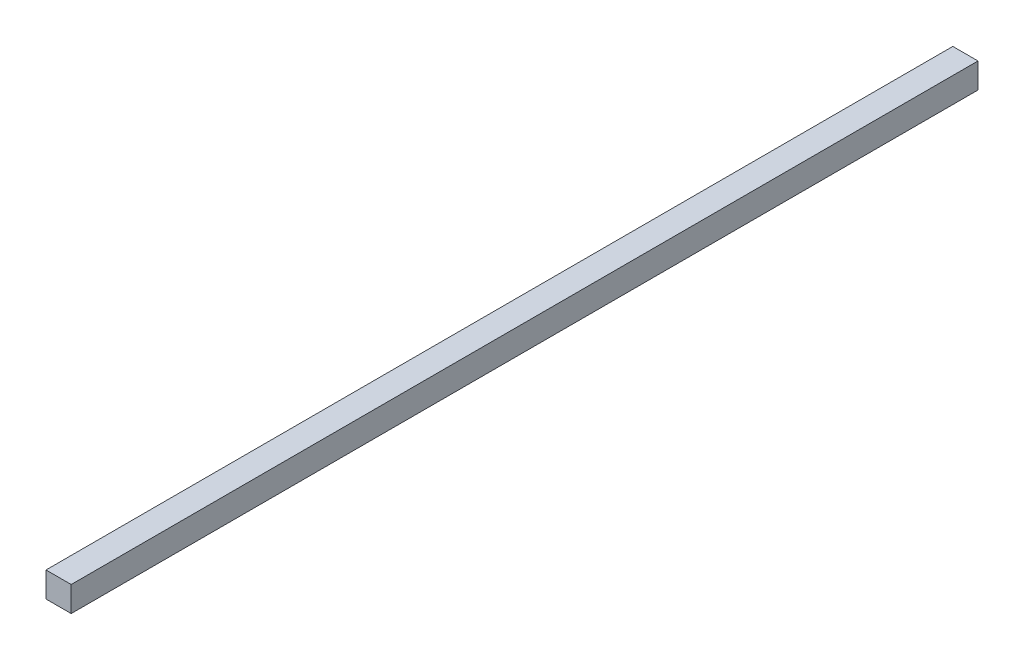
SolidWorks part; units mm, degrees
ref_plane "Front Plane" through (0, 0, 0) normal (0, 0, 1) x (1, 0, 0)
ref_plane "Top Plane" through (0, 0, 0) normal (0, 1, 0) x (1, 0, 0)
ref_plane "Right Plane" through (0, 0, 0) normal (1, 0, 0) x (0, 0, -1)
ref_plane "Plane1" through (0, 6.35, 0) normal (0, 1, 0) x (-1, 0, 0)
sketch "Sketch1" plane through (0, 6.35, 0) normal (0, 1, 0) x (-1, 0, 0)
  line L0 (-6.35, 228.6) -> (-6.35, 0)
  line L1 (-6.35, 0) -> (0, 0)
  line L2 (0, 0) -> (0, 228.6)
  line L3 (0, 228.6) -> (-6.35, 228.6)
  dimension "D1" = 6.35
  dimension "D2" = 228.6
extrude "Boss-Extrude1" add sketch "Sketch1" against normal blind 6.35
